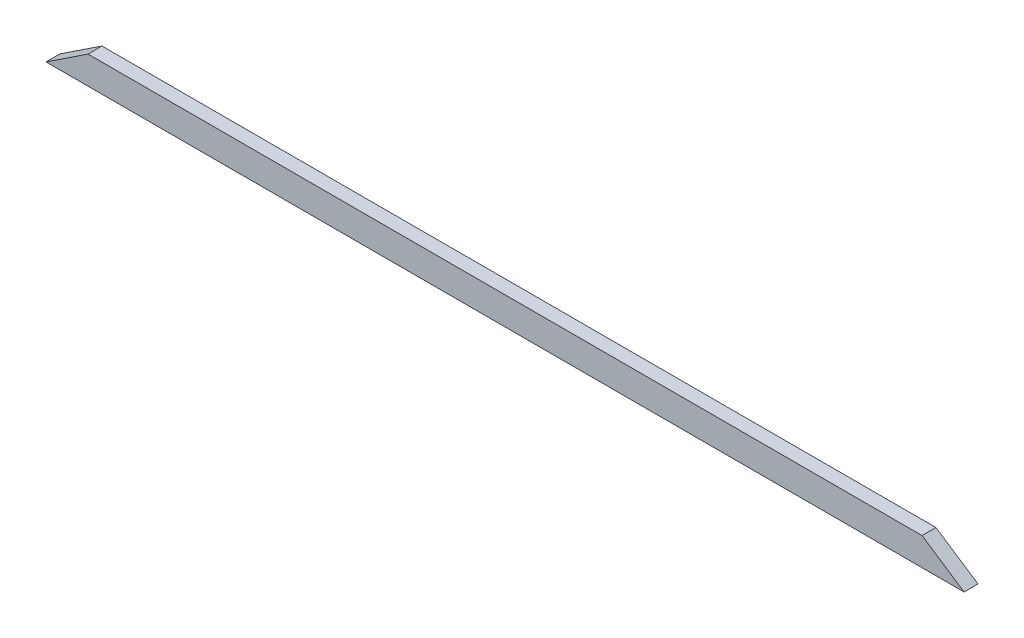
SolidWorks part; units mm, degrees
ref_plane "Face" through (0, 0, 0) normal (0, 0, 1) x (1, 0, 0)
ref_plane "Dessus" through (0, 0, 0) normal (0, 1, 0) x (1, 0, 0)
ref_plane "Droite" through (0, 0, 0) normal (1, 0, 0) x (0, 0, -1)
sketch "Esquisse1" plane through (0, 0, 0) normal (0, 0, 1) x (1, 0, 0)
  line L0 (317.7852, 0) -> (302.6711, 10)
  line L1 (-12.2148, 0) -> (317.7852, 0)
  line L2 (-12.2148, 0) -> (2.8993, 10)
  line L3 (2.8993, 10) -> (302.6711, 10)
  dimension "D1" = 10
  dimension "D2" = 330
  dimension "D3" = 146.51
  dimension "D4" = 146.51
extrude "Extrusion1" add sketch "Esquisse1" along normal blind 5
